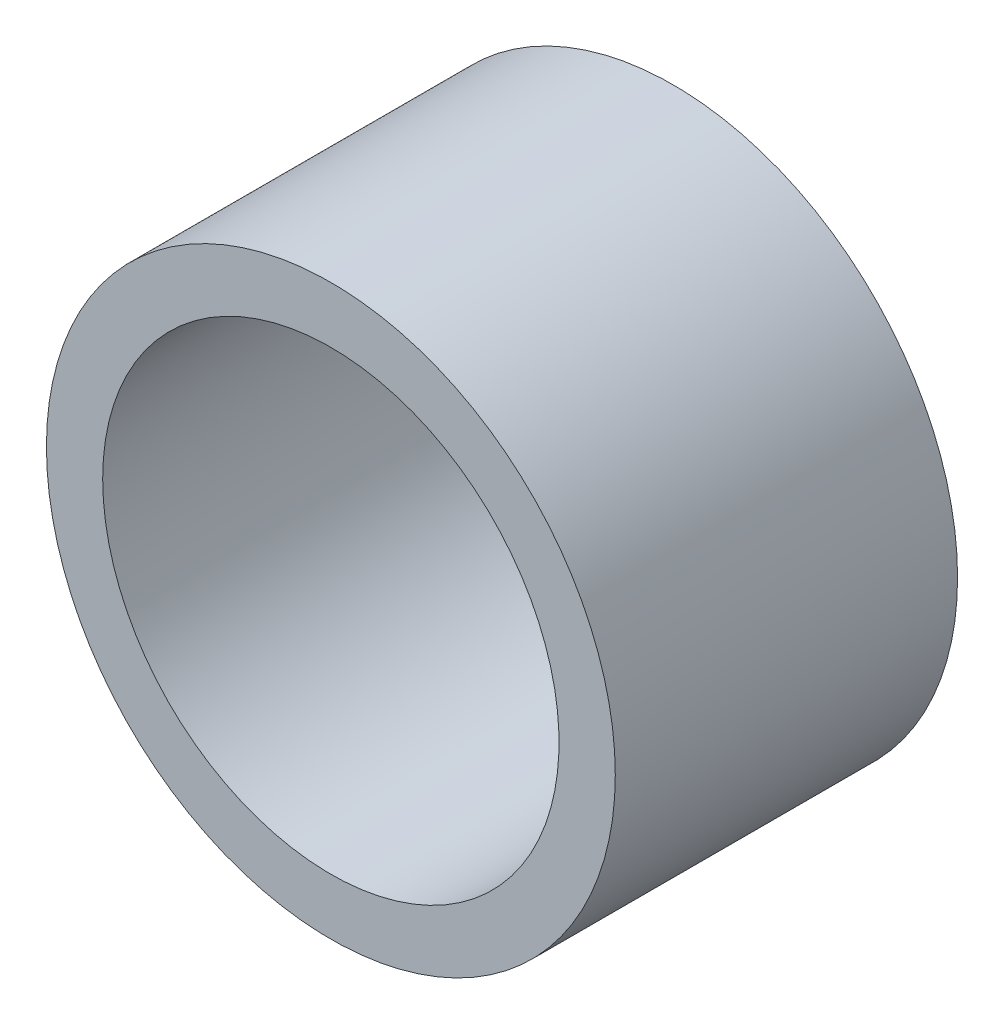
SolidWorks part; units mm, degrees
ref_plane "Front" through (0, 0, 0) normal (0, 0, 1) x (1, 0, 0)
ref_plane "Top" through (0, 0, 0) normal (0, 1, 0) x (1, 0, 0)
ref_plane "Right" through (0, 0, 0) normal (1, 0, 0) x (0, 0, -1)
sketch "Sketch1" plane through (0, 0, 0) normal (0, 0, 1) x (1, 0, 0)
  circle A0 centre (0, 0) radius 25.4
  circle A1 centre (0, 0) radius 31.6611
  dimension "D1" = 50.8
  dimension "D2" = 63.3222
extrude "Extrude1" add sketch "Sketch1" along normal blind 38.1
